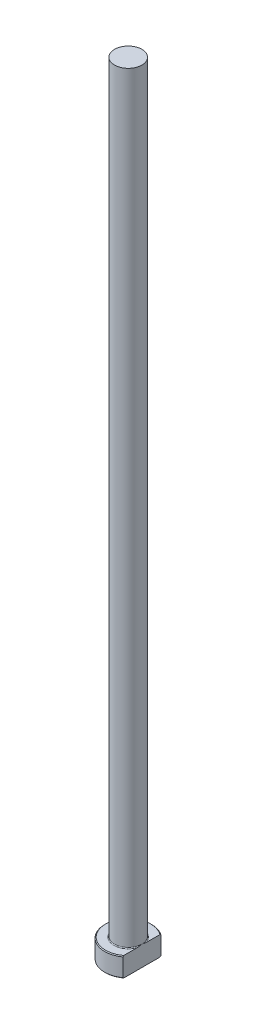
SolidWorks part; units mm, degrees
ref_plane "Front Plane" through (0, 0, 0) normal (0, 0, 1) x (1, 0, 0)
ref_plane "Top Plane" through (0, 0, 0) normal (0, 1, 0) x (1, 0, 0)
ref_plane "Right Plane" through (0, 0, 0) normal (1, 0, 0) x (0, 0, -1)
sketch "Sketch1" plane through (0, 0, 0) normal (0, 0, 1) x (1, 0, 0)
  line L0 (0, 259.9588) -> (0, -15.1925) construction
  line L1 (0, 0) -> (-6, 0)
  line L2 (-6, 0) -> (-6, 5)
  line L3 (-6, 5) -> (-3.5, 5)
  line L4 (-3.5, 5) -> (-3.5, 200)
  line L5 (-3.5, 200) -> (0, 200)
  line L6 (0, 200) -> (0, 0)
  dimension "L" = 200
  dimension "H" = 12
  dimension "T" = 5
  dimension "D" = 7
revolve "Revolve1" add sketch "Sketch1" angle 360 about L0
chamfer "Chamfer1" distance 0.2 angle 45 2 edges at (0, 5, 6) (0, 0, 6)
fillet "Fillet1" radius 0.2 1 edges at (0, 5, 3.5)
sketch "Sketch2" plane through (0, 0, 0) normal (0, 1, 0) x (1, 0, 0)
  line L0 (3.5, 4.8734) -> (3.5, -4.8734)
  circle A0 centre (0, 0) radius 6 construction
  arc A1 (3.5, -4.8734) -> (3.5, 4.8734) centre (0, 0) ccw
  circle A2 centre (0, 0) radius 3.5 construction
extrude "KEY" cut sketch "Sketch2" along normal through all
